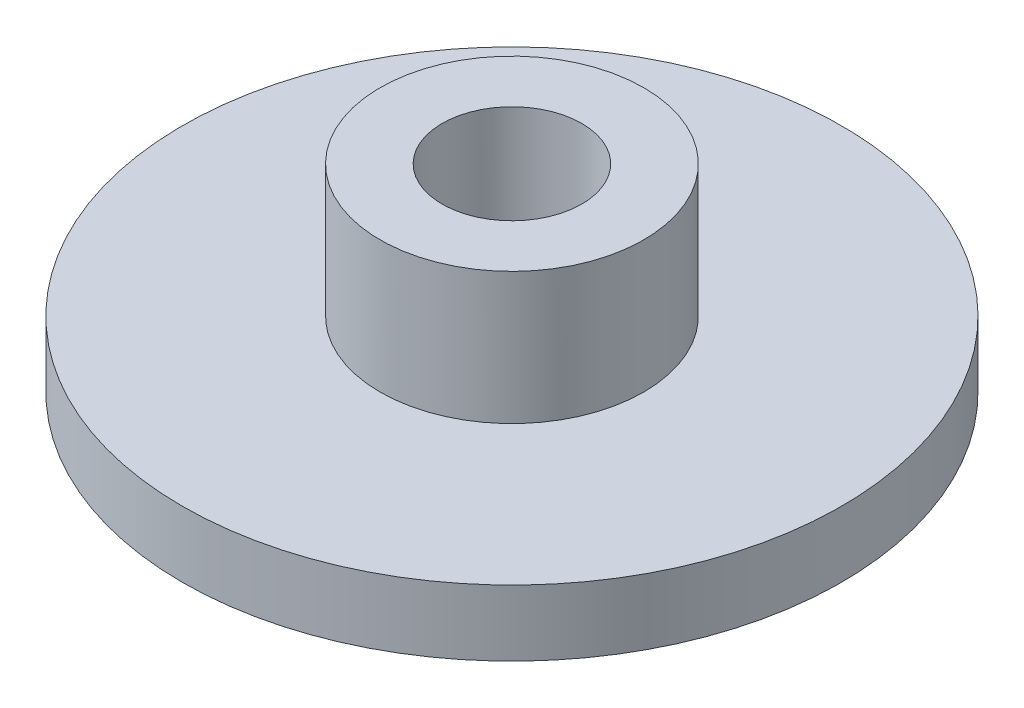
SolidWorks part; units mm, degrees
ref_plane "Front" through (0, 0, 0) normal (0, 0, 1) x (1, 0, 0)
ref_plane "Top" through (0, 0, 0) normal (0, 1, 0) x (1, 0, 0)
ref_plane "Right" through (0, 0, 0) normal (1, 0, 0) x (0, 0, -1)
sketch "Sketch1" plane through (0, 0, 0) normal (0, 1, 0) x (1, 0, 0)
  circle A0 centre (0, 0) radius 13.462
  circle A1 centre (0, 0) radius 63.5
  dimension "D1" = 127
  dimension "D2" = 26.924
extrude "Extrude1" add sketch "Sketch1" along normal blind 12.7
sketch "Sketch2" plane through (0, 12.7, 0) normal (0, -1, 0) x (1, 0, 0)
  circle A0 centre (0, 0) radius 13.462
  circle A1 centre (0, 0) radius 25.4
  dimension "D2" = 50.8
extrude "Extrude2" add sketch "Sketch2" against normal blind 25.4
